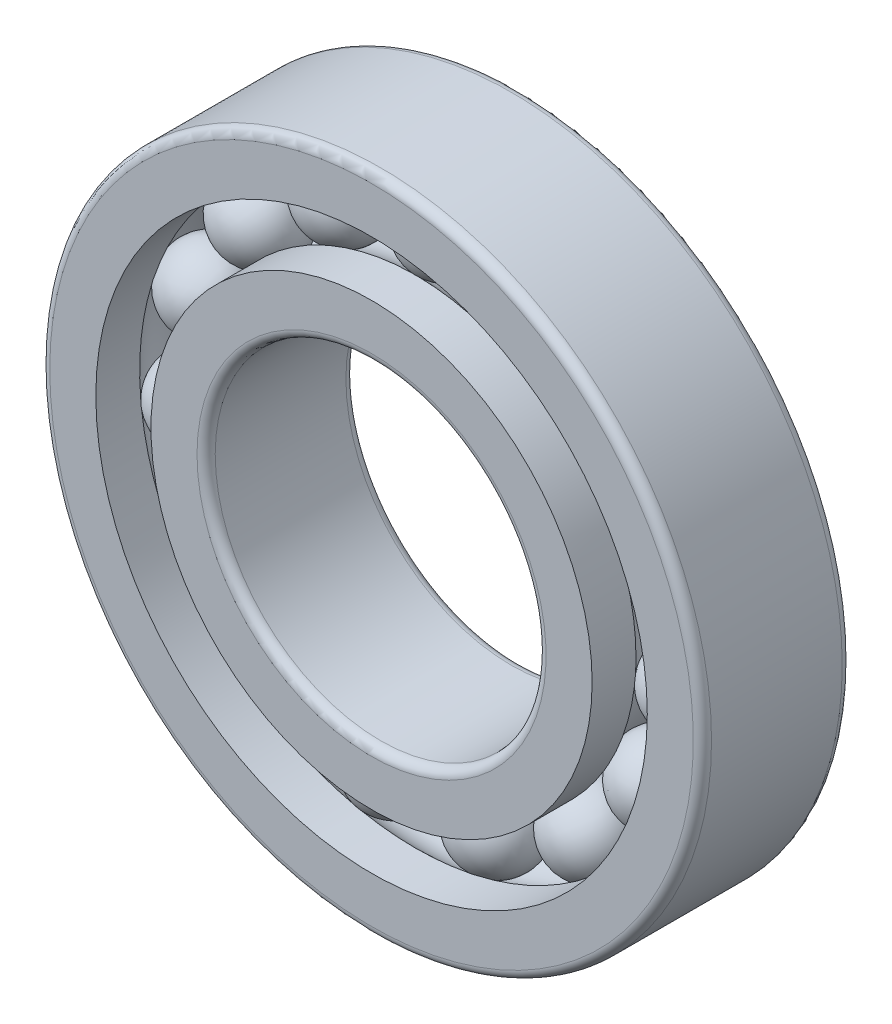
SolidWorks part; units mm, degrees
ref_plane "Front Plane" through (0, 0, 0) normal (0, 0, 1) x (1, 0, 0)
ref_plane "Top Plane" through (0, 0, 0) normal (0, 1, 0) x (1, 0, 0)
ref_plane "Right Plane" through (0, 0, 0) normal (1, 0, 0) x (0, 0, -1)
sketch "BaseSke" plane through (0, 0, 0) normal (1, 0, 0) x (0, 0, -1)
  line L0 (-47.2296, 0) -> (24.6132, 0) construction
  line L1 (-47.2296, 30) -> (24.6132, 30) construction
  line L2 (0, 129.5214) -> (0, -86.3012) construction
  line L3 (0, 35) -> (0, 25)
  line L4 (-9, 40) -> (9, 40) construction
  line L5 (-9, 20) -> (9, 20) construction
  arc A0 (0, 35) -> (0, 25) centre (0, 30) ccw
  dimension "Ball_diameter" = 10
  dimension "D1" = 30
  dimension "Bearing_Thickness" = 18
  dimension "Bearing_Outside_Diameter" = 80
  dimension "Bearing_Inside_Diameter" = 40
revolve "Ball" add sketch "BaseSke" angle 360 about L3
sketch "OuterRaceSke" plane through (0, 0, 0) normal (1, 0, 0) x (0, 0, -1)
  line L0 (0, 0) -> (0, 87.5396) construction
  line L1 (-9, 40) -> (9, 40)
  line L2 (-9, 40) -> (-9, 33.3333)
  line L3 (-9, 33.3333) -> (-3.7012, 33.3333)
  line L4 (9, 40) -> (9, 33.3333)
  line L5 (-50.3916, 0) -> (55.2197, 0) construction
  line L6 (-47.2296, 30) -> (24.6132, 30) construction
  line L7 (3.7012, 33.3333) -> (9, 33.3333)
  arc A0 (3.7012, 33.3333) -> (-3.7012, 33.3333) centre (0, 30) ccw
  dimension "D4" = 9.962
  dimension "D2" = 66.6667
revolve "OuterRace" add sketch "OuterRaceSke" angle 360 about L5
sketch "InnerRaceSke" plane through (0, 0, 0) normal (1, 0, 0) x (0, 0, -1)
  line L0 (-70.8626, 0) -> (113.5527, 0) construction
  line L1 (0, 58.441) -> (0, -70.8113) construction
  line L2 (-9, 20) -> (9, 20)
  line L3 (-9, 20) -> (-9, 26.6667)
  line L4 (-9, 26.6667) -> (-3.7012, 26.6667)
  line L5 (9, 20) -> (9, 26.6667)
  line L6 (0, 129.5214) -> (0, -86.3012) construction
  line L7 (3.7012, 26.6667) -> (9, 26.6667)
  arc A0 (-3.7012, 26.6667) -> (3.7012, 26.6667) centre (0, 30) ccw
  arc A1 (0, 35) -> (0, 25) centre (0, 30) ccw construction
  dimension "D2" = 9.962
  dimension "D1" = 53.3333
revolve "InnerRace" add sketch "InnerRaceSke" angle 360 about L0
fillet "Fillet1" radius 1.1 4 edges at (20, 0, -9) (20, 0, 9) (40, 0, -9) (40, 0, 9)
pattern_circular "CirPatternBall" count 15 over 360 about axis through (0, 0, 0) along (0, 0, 1) of "Ball"
sketch "SimplifiedSke" plane through (0, 0, 0) normal (1, 0, 0) x (0, 0, -1)
  line L0 (37.5911, 0) -> (-37.5911, 0) construction
  circle A0 centre (0, 30) radius 5
  arc A1 (0, 35) -> (0, 25) centre (0, 30) ccw construction
revolve "Simplified" [suppressed] add sketch "SimplifiedSke" angle 360 about L0
equation "\"D1@BaseSke\" =  (\"Bearing_Outside_Diameter@BaseSke\"  +  \"Bearing_Inside_Diameter@BaseSke\"  )  / 4"
equation "\"Ball_diameter@BaseSke\" =  ( \"Bearing_Outside_Diameter@BaseSke\" - \"Bearing_Inside_Diameter@BaseSke\" ) / 4 "
equation "\"D2@OuterRaceSke\" = \"Bearing_Outside_Diameter@BaseSke\" -  ( \"Bearing_Outside_Diameter@BaseSke\" - \"Bearing_Inside_Diameter@BaseSke\" )  / 3"
equation "\"D4@OuterRaceSke\" = (  \"Bearing_Outside_Diameter@BaseSke\" - \"Bearing_Inside_Diameter@BaseSke\" ) / 4 -0.02-\"Bearing_Thickness@BaseSke\" * 0.001"
equation "\"D1@InnerRaceSke\" = \"Bearing_Inside_Diameter@BaseSke\" +  ( \"Bearing_Outside_Diameter@BaseSke\" - \"Bearing_Inside_Diameter@BaseSke\" )  / 3"
equation "\"D2@InnerRaceSke\" = \"D4@OuterRaceSke\""
equation "\"D1@CirPatternBall\" = int( (  \"D1@BaseSke\"* pi  * 2 / \"Ball_diameter@BaseSke\"  ) * 0.8 )"
